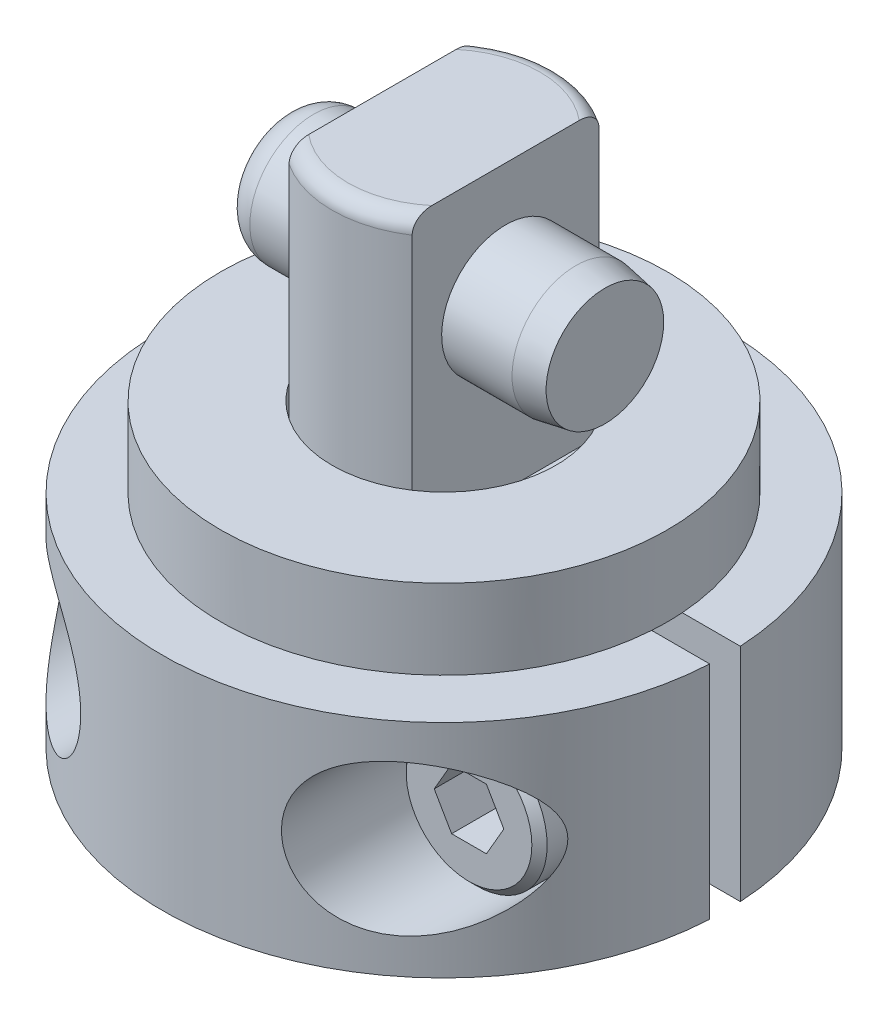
SolidWorks part; units mm, degrees
ref_plane "Front Plane" through (0, 0, 0) normal (0, 0, 1) x (1, 0, 0)
ref_plane "Top Plane" through (0, 0, 0) normal (0, 1, 0) x (1, 0, 0)
ref_plane "Right Plane" through (0, 0, 0) normal (1, 0, 0) x (0, 0, -1)
sketch "Sketch1" plane through (0, 0, 0) normal (1, 0, 0) x (0, 0, -1)
  line L0 (0, 21.2344) -> (5.5626, 21.2344)
  line L1 (5.5626, 21.2344) -> (5.5626, 0.6096)
  line L2 (5.5626, 0.6096) -> (2.9972, 0.6096)
  line L3 (2.9972, 0.6096) -> (2.9972, -5.7404)
  line L4 (2.9972, -5.7404) -> (0, -5.7404)
  line L5 (0, -5.7404) -> (0, 21.2344)
  line L6 (0, -15.3594) -> (0, 43.147) construction
  dimension "D1" = 26.9748
  dimension "D2" = 6.35
  dimension "D3" = 5.9944
  dimension "D4" = 11.1252
  dimension "D5" = 0.6096
revolve "Revolve1" add sketch "Sketch1" angle 360 about L6
fillet "Fillet1" radius 0.7874 1 edges at (0, 21.2344, -5.5626)
sketch "Sketch2" plane through (0, 0, 0) normal (0, 0, 1) x (1, 0, 0)
  line L0 (3.0607, 21.2344) -> (5.5626, 21.2344)
  line L1 (5.5626, 21.2344) -> (5.5626, 7.1628)
  line L2 (5.5626, 7.1628) -> (3.0607, 7.1628)
  line L3 (3.0607, 7.1628) -> (3.0607, 21.2344)
  line L4 (-5.5626, 21.2344) -> (-3.0607, 21.2344)
  line L5 (-3.0607, 21.2344) -> (-3.0607, 7.1628)
  line L6 (-3.0607, 7.1628) -> (-5.5626, 7.1628)
  line L7 (-5.5626, 7.1628) -> (-5.5626, 21.2344)
  line L8 (0, 5.9766) -> (0, 42.131) construction
  line L9 (4.7752, 21.2344) -> (-4.7752, 21.2344) construction
  line L10 (5.5626, 0.6096) -> (5.5626, 20.447) construction
  line L11 (-5.5626, 20.447) -> (-5.5626, 0.6096) construction
  dimension "D1" = 6.1214
  dimension "D2" = 14.0716
extrude "Cut-Extrude1" cut sketch "Sketch2" against normal through all and the other way through all
sketch "Sketch3" plane through (0, 0.6096, 0) normal (0, -1, 0) x (1, 0, 0)
  circle A0 centre (0, 0) radius 2.413
  circle A1 centre (0, 0) radius 2.9972 construction
  circle A2 centre (0, 0) radius 2.9972
  dimension "D1" = 4.826
extrude "Cut-Extrude2" cut sketch "Sketch3" along normal blind 2.54
chamfer "Chamfer1" distance 0.762 angle 45 1 edges at (0, -5.7404, -2.9972)
sketch "Sketch4" plane through (0, 0, 0) normal (1, 0, 0) x (0, 0, -1)
  line L0 (-5.5626, 0.6096) -> (5.5626, 0.6096) construction
  circle A0 centre (0, 15.3924) radius 3.1775
  dimension "D1" = 6.3551
  dimension "D2" = 14.7828
extrude "Extrude1" add sketch "Sketch4" along normal mid plane 16.002
chamfer "Chamfer2" distance 0.254 angle 80 1 edges at (8.001, 15.3924, -3.1775)
fillet "Fillet2" radius 1.524 1 edges at (-8.001, 15.3924, -3.1775)
sketch "Sketch5" plane through (0, 0, 0) normal (0, 1, 0) x (1, 0, 0)
  line L0 (5.5102, 0.762) -> (13.9746, 0.762)
  line L1 (5.5102, -0.762) -> (13.9746, -0.762)
  line L2 (-5.5102, -0.762) -> (-13.9746, -0.762)
  line L3 (-5.5102, 0.762) -> (-13.9746, 0.762)
  line L4 (0, 0) -> (24.3028, 0) construction
  arc A0 (13.9746, 0.762) -> (-13.9746, 0.762) centre (0, 0) ccw
  arc A1 (-13.9746, -0.762) -> (13.9746, -0.762) centre (0, 0) ccw
  arc A2 (5.5102, 0.762) -> (-5.5102, 0.762) centre (0, 0) ccw
  arc A3 (-5.5102, -0.762) -> (5.5102, -0.762) centre (0, 0) ccw
  circle A4 centre (0, 0) radius 5.5626 construction
  dimension "D2" = 13.9954
  dimension "D1" = 1.524
extrude "Extrude2" add sketch "Sketch5" along normal blind 5.4991 and the other way blind 5.4991
sketch "Sketch6" plane through (0, 0, 0.762) normal (0, 0, 1) x (1, 0, 0)
  line L0 (0, -5.6718) -> (0, 5.6718) construction
  line L1 (-13.9746, -5.4991) -> (13.9746, -5.4991) construction
  circle A0 centre (8.7376, 0) radius 3.7465
  circle A1 centre (-8.7376, 0) radius 3.7465
  dimension "D1" = 7.493
  dimension "D2" = 17.4752
  dimension "D3" = 5.4991
extrude "Cut-Extrude3" cut sketch "Sketch6" along normal through all from offset 2.7432
sketch "Sketch7" plane through (0, 0, 3.5052) normal (0, 0, 1) x (1, 0, 0)
  circle A0 centre (8.7376, 0) radius 3.5052
  circle A1 centre (-8.7376, 0) radius 3.5052
  circle A3 centre (-8.7376, 0) radius 3.7465 construction
  circle A4 centre (8.7376, 0) radius 3.7465 construction
  dimension "D1" = 7.0104
extrude "Extrude3" add sketch "Sketch7" along normal blind 3.9878
chamfer "Chamfer3" distance 0.381 angle 45 2 edges at (-5.2324, 0, 7.493) (12.2428, 0, 7.493)
sketch "Sketch8" plane through (0, 0, 7.493) normal (0, 0, 1) x (1, 0, 0)
  line L0 (0, 0) -> (0, -21.769) construction
  line L1 (9.6028, 1.4986) -> (10.468, 0)
  line L2 (7.8724, 1.4986) -> (9.6028, 1.4986)
  line L3 (7.0072, 0) -> (7.8724, 1.4986)
  line L4 (7.8724, -1.4986) -> (7.0072, 0)
  line L5 (9.6028, -1.4986) -> (7.8724, -1.4986)
  line L6 (10.468, 0) -> (9.6028, -1.4986)
  line L8 (-10.468, 0) -> (-9.6028, -1.4986)
  line L9 (-9.6028, -1.4986) -> (-7.8724, -1.4986)
  line L10 (-7.8724, -1.4986) -> (-7.0072, 0)
  line L11 (-7.0072, 0) -> (-7.8724, 1.4986)
  line L12 (-7.8724, 1.4986) -> (-9.6028, 1.4986)
  line L13 (-9.6028, 1.4986) -> (-10.468, 0)
  circle A0 centre (-8.7376, 0) radius 1.4986 construction
  circle A1 centre (8.7376, 0) radius 1.4986 construction
  dimension "D2" = 2.9972
extrude "Cut-Extrude4" cut sketch "Sketch8" against normal blind 2.9972
sketch "Sketch10" plane through (0, 0, 0) normal (0, 0, 1) x (1, 0, 0)
  circle A0 centre (8.7376, 0) radius 1.9939
  circle A1 centre (-8.7376, 0) radius 1.9939
  circle A2 centre (-8.7376, 0) radius 3.5052 construction
  circle A3 centre (8.7376, 0) radius 3.5052 construction
  dimension "D1" = 3.9878
extrude "Extrude4" add sketch "Sketch10" along normal up to next and the other way up to next
sketch "Sketch11" plane through (0, 5.4991, 0) normal (0, 1, 0) x (-1, 0, 0)
  circle A0 centre (0, 0) radius 11.1125
  circle A1 centre (0, 0) radius 5.5626
  circle A3 centre (0, 0) radius 2.9972 construction
  dimension "D1" = 22.225
  dimension "D2" = 11.1252
extrude "Extrude5" add sketch "Sketch11" along normal blind 3.9624
